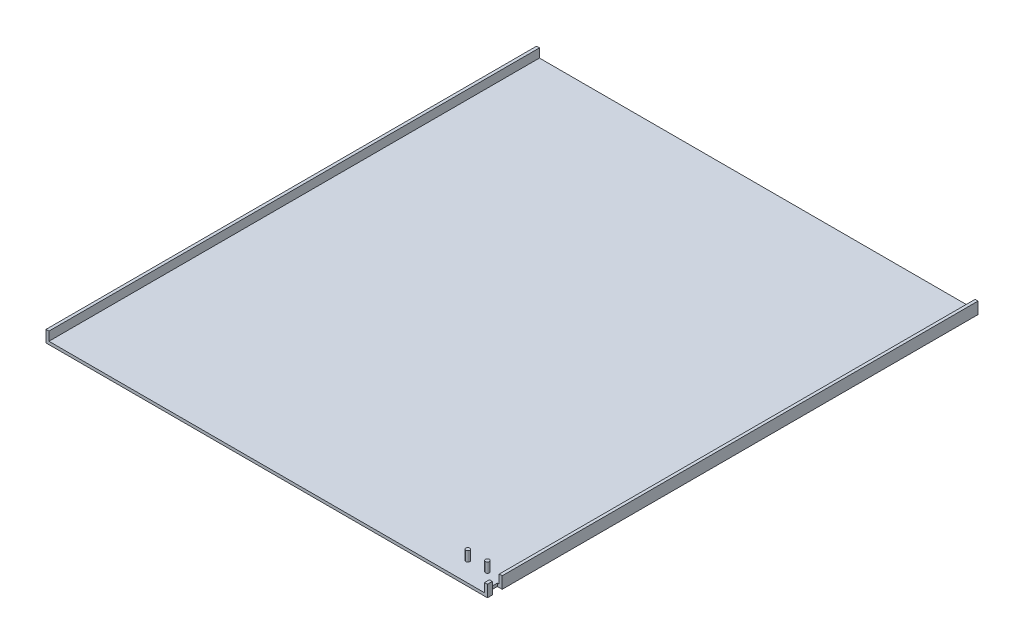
SolidWorks part; units mm, degrees
ref_plane "Ebene vorne" through (0, 0, 0) normal (0, 0, 1) x (1, 0, 0)
ref_plane "Ebene oben" through (0, 0, 0) normal (0, 1, 0) x (1, 0, 0)
ref_plane "Ebene rechts" through (0, 0, 0) normal (1, 0, 0) x (0, 0, -1)
sketch "Skizze1" plane through (0, 0, 0) normal (0, 0, 1) x (1, 0, 0)
  line L0 (0, 12) -> (0, 0)
  line L1 (0, 0) -> (450, 0)
  line L2 (450, 0) -> (450, 12)
  dimension "D1" = 450
  dimension "D2" = 12
  dimension "D3" = 12
extrude "Linear-Austragen-Dünn1" add sketch "Skizze1" along normal blind 500 thin
sketch "Skizze2" plane through (0, 3, 0) normal (0, 1, 0) x (1, 0, 0)
  line L0 (450, -500) -> (450, 0) construction
  line L1 (3, -500) -> (447, -500) construction
  circle A0 centre (430, -480) radius 2
  circle A1 centre (410, -480) radius 2
  dimension "D5" = 4
  dimension "D6" = 4
  dimension "D1" = 20
  dimension "D2" = 20
  dimension "D3" = 20
  dimension "D4" = 20
extrude "Aufsatz-Linear austragen1" add sketch "Skizze2" along normal blind 10
sketch "Skizze3" plane through (450, 0, 0) normal (1, 0, 0) x (0, 0, -1)
  line L0 (-500, 0) -> (0, 0) construction
  line L1 (-495, 0) -> (-485, 0)
  line L2 (-495, 0) -> (-495, 12)
  line L3 (-495, 12) -> (-485, 12)
  line L4 (-485, 0) -> (-485, 12)
  line L5 (-500, 12) -> (0, 12) construction
  line L6 (-500, 0) -> (-500, 12) construction
  dimension "D1" = 5
  dimension "D2" = 10
extrude "Schnitt-Linear austragen1" cut sketch "Skizze3" against normal blind 5
